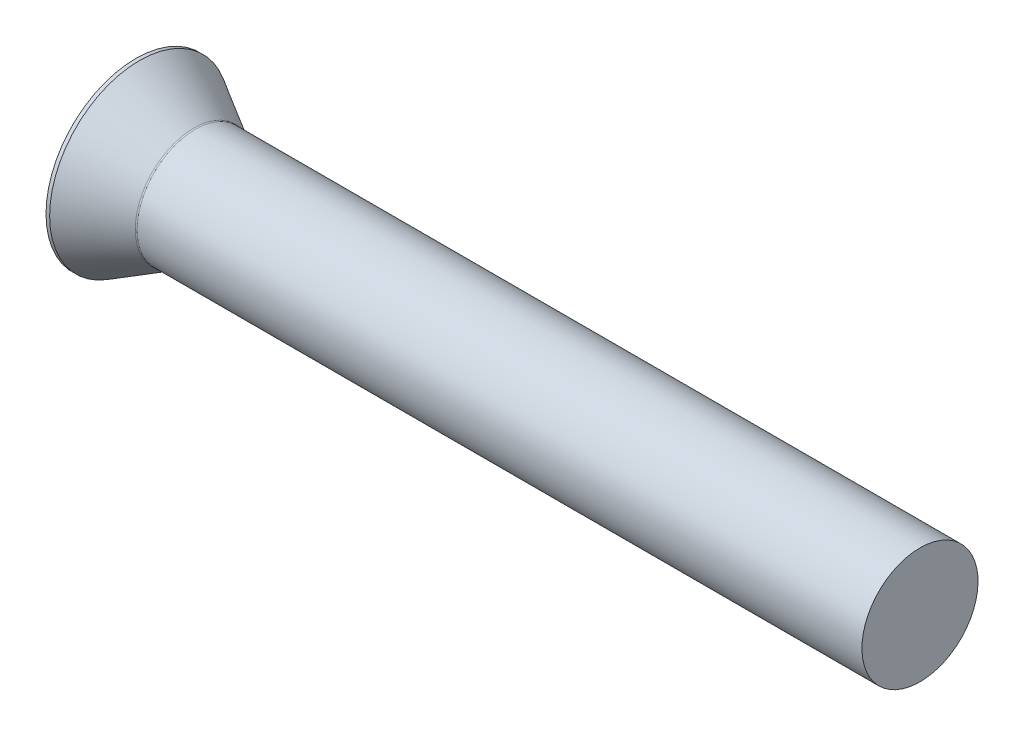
SolidWorks part; units mm, degrees
ref_plane "Front" through (0, 0, 0) normal (0, 0, 1) x (1, 0, 0)
ref_plane "Top" through (0, 0, 0) normal (0, 1, 0) x (1, 0, 0)
ref_plane "Right" through (0, 0, 0) normal (1, 0, 0) x (0, 0, -1)
sketch "Sketch3" plane through (19.4681, 10.942, 0) normal (0, 0, 1) x (0, 1, 0)
  line L0 (-10.942, 30.4893) -> (-10.942, -15.4792) construction
  line L3 (-2.942, 8.0681) -> (-10.942, 8.0681)
  line L4 (-2.942, 8.0681) -> (1.4324, 15.6448)
  line L5 (1.4324, 15.6448) -> (1.4324, 16.1448)
  line L6 (-10.942, 19.4681) -> (-10.942, 8.0681)
  arc A0 (1.4324, 16.1448) -> (-10.942, 19.4681) centre (-10.942, -5.2319) ccw
  dimension "D1" = 8
  dimension "R" = 24.7
  dimension "K" = 11.4
  dimension "α" = 30
  dimension "b" = 0.5
revolve "BaseHead" add sketch "Sketch3" angle 360 about L0
sketch "Sketch2" plane through (11.4, 0.1081, -0.5592) normal (1, 0, 0) x (0, 0, -1)
  circle A0 centre (-0.5592, -0.1081) radius 8
  circle A1 centre (-0.5592, -0.1081) radius 8 construction
  dimension "d" = 16
extrude "BaseBody" add sketch "Sketch2" along normal blind 100
fillet "Fillet1" radius 0.4 1 edges at (11.4, 8, 0)
equation "\"D1@Sketch3\"=\"d@Sketch2\"/2"
